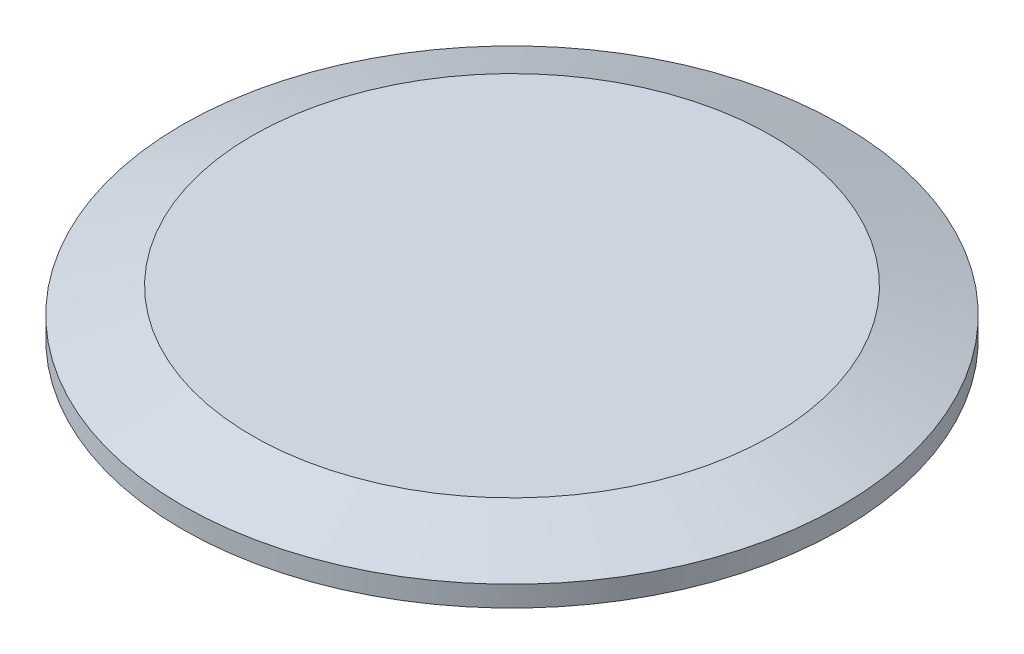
SolidWorks part; units mm, degrees
ref_plane "Front Plane" through (0, 0, 0) normal (0, 0, 1) x (1, 0, 0)
ref_plane "Top Plane" through (0, 0, 0) normal (0, 1, 0) x (1, 0, 0)
ref_plane "Right Plane" through (0, 0, 0) normal (1, 0, 0) x (0, 0, -1)
sketch "Sketch1" plane through (0, 0, 0) normal (0, 0, 1) x (1, 0, 0)
  line L0 (0, 0) -> (-39.8507, 0)
  line L1 (-45.4533, 0) -> (-45.4533, 2.8448)
  line L2 (-45.4533, 2.8448) -> (-35.8228, 6.35)
  line L3 (-35.8228, 6.35) -> (0, 6.35)
  line L4 (0, 6.35) -> (0, 0) construction
  line L5 (-43.4867, 0) -> (-45.4533, 0)
  line L6 (0, 0) -> (0, 6.35)
  arc A0 (-40.5732, 0.4745) -> (-42.7642, 0.4745) centre (-41.6687, 0) ccw
  arc A1 (-39.8507, 0) -> (-40.5732, 0.4745) centre (-39.8507, 0.7874) cw
  arc A2 (-43.4867, 0) -> (-42.7642, 0.4745) centre (-43.4867, 0.7874) ccw
  point P13 (-42.8625, 0)
  dimension "D1" = 2.3876
  dimension "D2" = 0.7874
  dimension "D3" = 45.4533
  dimension "D4" = 41.6687
  dimension "D5" = 2.8448
  dimension "D6" = 20
  dimension "D7" = 6.35
revolve "Revolve1" add sketch "Sketch1" angle 360 about L4
